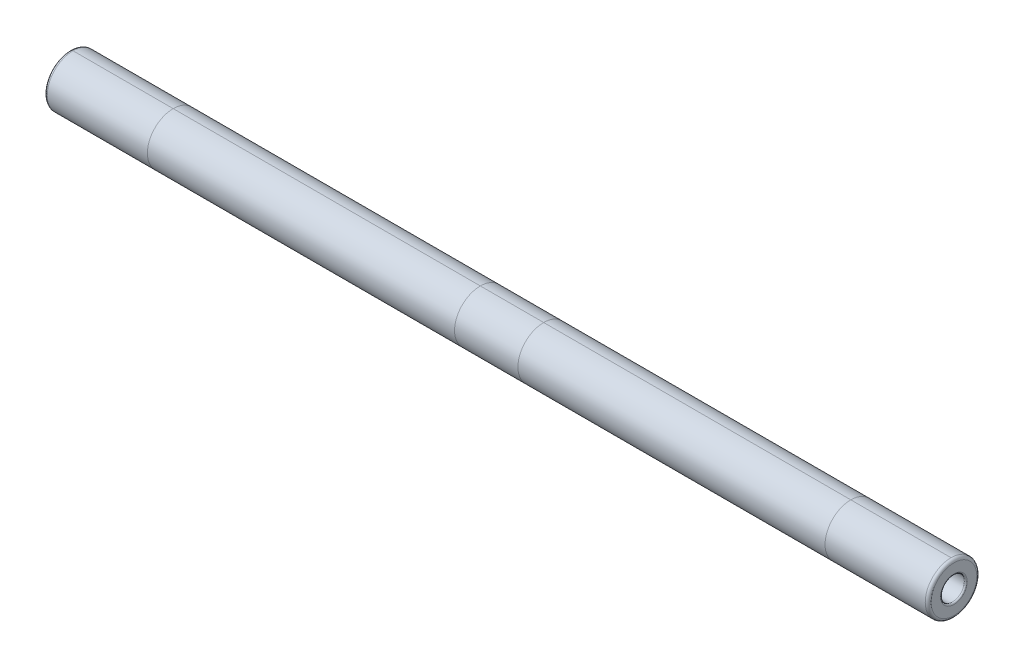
SolidWorks part; units mm, degrees
ref_plane "Front" through (0, 0, 0) normal (0, 0, 1) x (1, 0, 0)
ref_plane "Top" through (0, 0, 0) normal (0, 1, 0) x (1, 0, 0)
ref_plane "Right" through (0, 0, 0) normal (1, 0, 0) x (0, 0, -1)
sketch "Schizzo1" plane through (0, 0, 0) normal (0, 0, 1) x (1, 0, 0)
  line L0 (-300, 0) -> (300, 0)
  line L1 (-300, 0) -> (-300, 17.5)
  line L7 (300, 17.5) -> (300, 0)
  line L9 (-300, 17.5) -> (300, 17.5)
  point P3 (0, 0)
  dimension "D1" = 600
  dimension "D2" = 17.5
revolve "Rivoluzione1" add sketch "Schizzo1" angle 360 about L0
fillet "Raccordo1" radius 2 2 edges at (300, -17.5, 0) (-300, -17.5, 0)
fillet "Raccordo2" [suppressed] radius 2
ref_plane "Piano1" through (0, 0, -40) normal (0, 0, 1) x (1, 0, 0)
sketch "Schizzo2" plane through (0, 0, -40) normal (0, 0, 1) x (1, 0, 0)
  line L1 (-300, 17.5) -> (300, 17.5)
  line L2 (-300, 17.5) -> (-300, -17.5)
  line L3 (-300, -17.5) -> (300, -17.5)
  line L8 (-21.5, -17.5) -> (-21.5, 17.5)
  line L9 (21.5, -17.5) -> (21.5, 17.5)
  line L10 (300, 17.5) -> (300, -17.5)
  line L11 (300, -15.5) -> (300, 15.5) construction
  line L12 (-300, 15.5) -> (-300, -15.5) construction
  line L13 (-230, 17.5) -> (-230, -17.5)
  line L14 (230, 17.5) -> (230, -17.5)
  point P8 (-300, 0)
sketch "Schizzo3" plane through (-300, 0, 0) normal (-1, 0, 0) x (0, 0, 1)
  circle A0 centre (0, 0) radius 8
  dimension "D1" = 16
extrude "Taglio-Estrusione1" cut sketch "Schizzo3" against normal blind 75
sketch "Schizzo4" plane through (300, 0, 0) normal (1, 0, 0) x (0, 0, -1)
  circle A1 centre (0, 0) radius 8
  circle A2 centre (0, 0) radius 8
  dimension "D1" = 0
extrude "Taglio-Estrusione2" cut sketch "Schizzo4" against normal blind 75
fillet "Raccordo3" radius 1 2 edges at (-300, -8, 0) (300, 8, 0)
equation "\"D2@Schizzo2\"=\"D1@Schizzo2\"/2"
